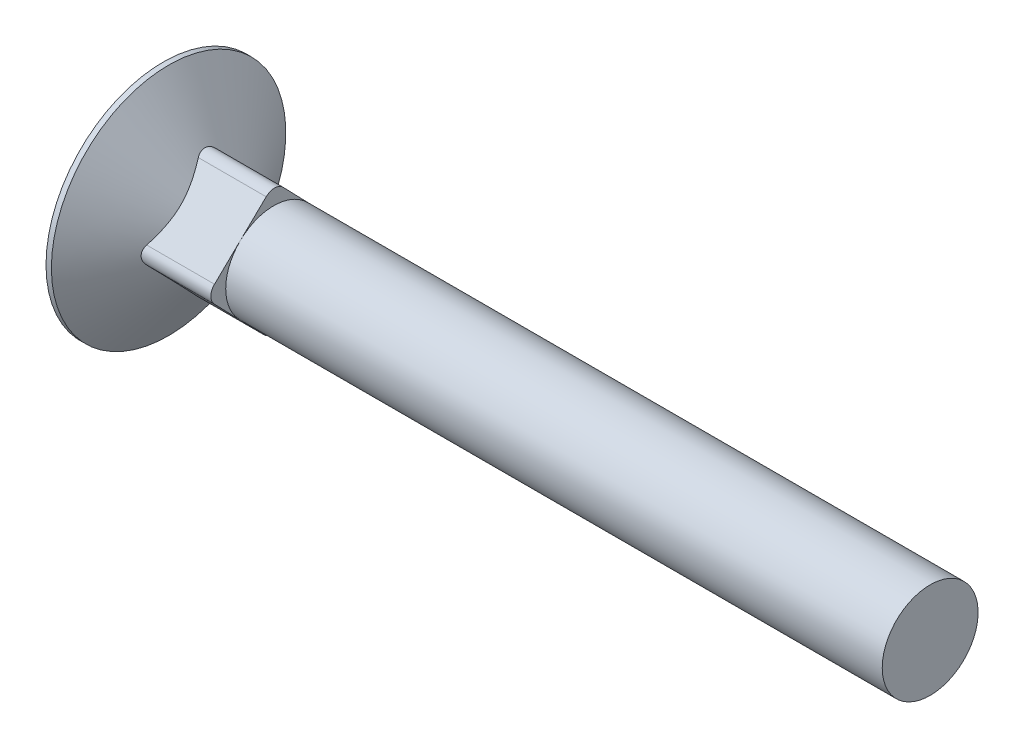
SolidWorks part; units mm, degrees
ref_plane "Plane1" through (0, 0, 0) normal (0, 0, 1) x (1, 0, 0)
ref_plane "Plane2" through (0, 0, 0) normal (0, 1, 0) x (1, 0, 0)
ref_plane "Plane3" through (0, 0, 0) normal (1, 0, 0) x (0, 0, -1)
sketch "BodySke" plane through (0, 0, 0) normal (0, 0, 1) x (1, 0, 0)
  line L0 (0, 0) -> (0, 11.6459)
  line L1 (0, 11.6459) -> (0.5337, 11.6459)
  line L2 (5.0038, 4.7625) -> (76.2, 4.7625)
  line L3 (76.2, 4.7625) -> (76.2, 0)
  line L4 (76.2, 0) -> (0, 0)
  line L5 (-6.35, 0) -> (82.55, 0) construction
  line L6 (5.0038, -4.7625) -> (76.2, -4.7625) construction
  line L7 (0.5337, -11.6459) -> (5.0038, -4.7625) construction
  line L8 (0.5337, 11.6459) -> (5.0038, 4.7625)
  line L9 (0, -11.6459) -> (0.5337, -11.6459) construction
  line L10 (74.6125, 9.525) -> (74.6125, 3.175) construction
  line L11 (38.1, 9.525) -> (38.1, 3.175) construction
  dimension "Diameter" = 9.525
  dimension "Length" = 76.2
  dimension "Head_ht" = 5.0038
  dimension "Head_dia" = 23.2918
  dimension "Head_ang" = 114
  dimension "D6" = 0.5337
  dimension "Advance" = 1.5875
  dimension "Thread_nom" = 38.1
revolve "Base-Revolve" add sketch "BodySke"
revolve "Cut-Revolve1" cut sketch "Sketch3" angle 360 about L5
sketch "Sketch3" plane through (0, 0, 0) normal (0, 0, 1) x (1, 0, 0)
  line L0 (-0.3337, 24.3459) -> (10.9728, 4.7625)
  line L1 (10.9728, 4.7625) -> (11.2268, 4.7625)
  line L2 (11.2268, 4.7625) -> (11.2268, 24.3459)
  line L3 (11.2268, 24.3459) -> (-0.3337, 24.3459)
  line L4 (0, 0) -> (22.225, 0) construction
  line L8 (0.5337, 11.6459) -> (0, 11.6459) construction
  dimension "D1" = 360
  dimension "D2" = 10.9728
  dimension "D3" = 120
  dimension "D4" = 0.254
  dimension "D5" = 4.7625
sketch "Sketch2" plane through (0, 0, 0) normal (1, 0, 0) x (0, 0.6947, -0.7193)
  line L1 (3.5687, -4.7625) -> (-3.5687, -4.7625)
  line L2 (4.7625, -3.5687) -> (4.7625, 3.5687)
  line L3 (3.5687, 4.7625) -> (-3.5687, 4.7625)
  line L4 (-4.7625, -3.5687) -> (-4.7625, 3.5687)
  arc A0 (3.5687, 4.7625) -> (4.7625, 3.5687) centre (3.5687, 3.5687) cw
  arc A1 (3.5687, -4.7625) -> (4.7625, -3.5687) centre (3.5687, -3.5687) ccw
  arc A2 (-4.7625, -3.5687) -> (-3.5687, -4.7625) centre (-3.5687, -3.5687) ccw
  arc A3 (-3.5687, 4.7625) -> (-4.7625, 3.5687) centre (-3.5687, 3.5687) ccw
  dimension "Neck_corner_radius" = 1.1938
  dimension "D1" = 4.7625
  dimension "Neck_width" = 9.525
  dimension "D2" = 9.525
  dimension "D3" = 4.7625
extrude "Neck" add sketch "Sketch2" along normal blind 10.9728
sketch "ThdSchSke" plane through (0, 0, 0) normal (0, 0, 1) x (1, 0, 0)
  line L0 (38.1, -3.8163) -> (37.4375, -4.7625)
  line L1 (38.1, -3.8163) -> (38.7625, -4.7625)
  line L2 (38.7625, -4.7625) -> (38.7625, -5.9531)
  line L3 (-3.175, 0) -> (5.1513, 0) construction
  line L5 (38.7625, -5.9531) -> (37.4375, -5.9531)
  line L6 (37.4375, -5.9531) -> (37.4375, -4.7625)
  line L7 (0, 11.6459) -> (0, -11.6459) construction
  dimension "Thread_minor" = 7.6327
  dimension "Diameter" = 9.525
  dimension "Start" = 38.1
  dimension "SideAngle" = 55
  dimension "VeeAngle" = 70
  dimension "Overcut" = 11.9063
revolve "ThreadSchematic" [suppressed] cut sketch "ThdSchSke" angle 360 about L3
pattern_linear "ThdSchPat" [suppressed]
equation "\"D1@Sketch2\" = \"Neck_width@Sketch2\"/2"
equation "\"D2@Sketch2\" = \"Neck_width@Sketch2\""
equation "\"D3@Sketch2\" = \"D2@Sketch2\"/2"
equation "\"D2@Sketch3\" = \"Neck_ht@Neck\""
equation "\"D5@Sketch3\" = \"Diameter@BodySke\"/2"
equation "\"Thread_length@ThreadCosmetic\" = ((sgn( (\"Length@BodySke\" - \"Advance@BodySke\" * 1.5 - \"Neck_ht@Neck\" ) - \"Thread_nom@BodySke\" )-1)*( (\"Length@BodySke\" - \"Advance@BodySke\" * 1.5 -  \"Neck_ht@Neck\" ) - \""
equation "\"Thread_minor@ThdSchSke\" = \"Thread_minor@ThreadCosmetic\""
equation "\"Diameter@ThdSchSke\" = \"Diameter@BodySke\""
equation "\"Overcut@ThdSchSke\" = \"Diameter@BodySke\" * 1.25"
equation "\"Start@ThdSchSke\" = 0.000001 + \"Length@BodySke\" - \"Thread_length@ThreadCosmetic\"  '---Countersunk---"
equation "\"Num_threads@ThdSchPat\" = int( \"Thread_length@ThreadCosmetic\" / \"Advance@BodySke\" + 0.999 )  + 1"
equation "\"Advance@ThdSchPat\" = \"Thread_length@ThreadCosmetic\" /  (\"Num_threads@ThdSchPat\" - 1) 'relax it"
